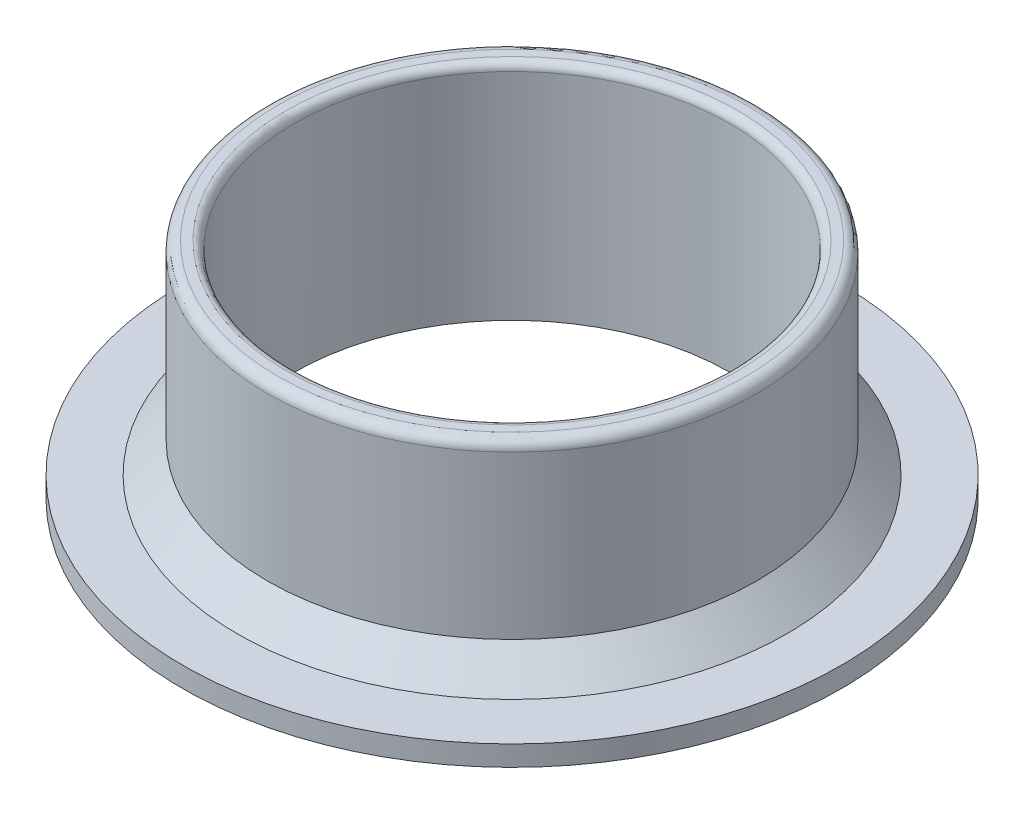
SolidWorks part; units mm, degrees
ref_plane "Front" through (0, 0, 0) normal (0, 0, 1) x (1, 0, 0)
ref_plane "Top" through (0, 0, 0) normal (0, 1, 0) x (1, 0, 0)
ref_plane "Right" through (0, 0, 0) normal (1, 0, 0) x (0, 0, -1)
sketch "Sketch1" plane through (0, 0, 0) normal (0, 1, 0) x (1, 0, 0)
  circle A0 centre (0, 0) radius 24.125
  circle A2 centre (0, 0) radius 21.5
  dimension "D1" = 48.25
  dimension "D2" = 43
extrude "Boss-Extrude1" add sketch "Sketch1" along normal mid plane 20
sketch "Sketch5" plane through (0, -10, 0) normal (0, -1, 0) x (1, 0, 0)
  circle A0 centre (0, 0) radius 32.5
  circle A1 centre (0, 0) radius 21.5 construction
  circle A2 centre (0, 0) radius 21.5
  dimension "D1" = 65
extrude "Boss-Extrude2" add sketch "Sketch5" along normal blind 2
chamfer "Chamfer1" distance 3 angle 45 1 edges at (0, -10, 24.125)
fillet "Fillet1" radius 1 1 edges at (0, 10, 24.125)
fillet "Fillet2" radius 0.75 1 edges at (0, 10, 21.5)
